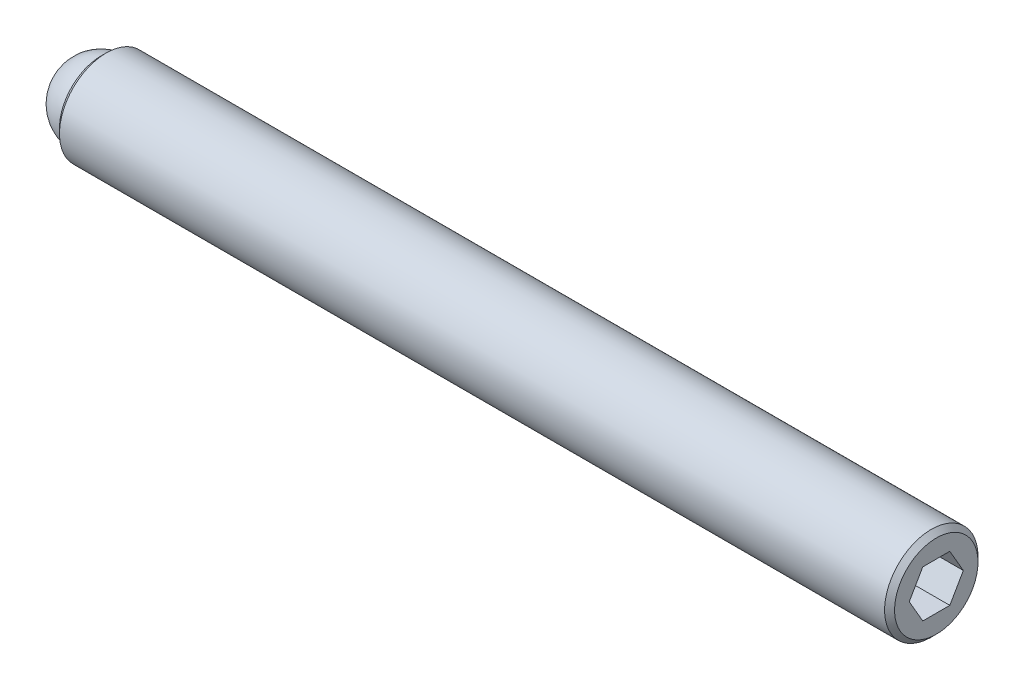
SolidWorks part; units mm, degrees
ref_plane "Front Plane" through (0, 0, 0) normal (0, 0, 1) x (1, 0, 0)
ref_plane "Top Plane" through (0, 0, 0) normal (0, 1, 0) x (1, 0, 0)
ref_plane "Right Plane" through (0, 0, 0) normal (1, 0, 0) x (0, 0, -1)
sketch "Sketch2" plane through (0, 0, 0) normal (1, 0, 0) x (0, 0, -1)
  circle A0 centre (0, 0) radius 2.3749
  dimension "D1" = 4.7498
extrude "Boss-Extrude1" add sketch "Sketch2" along normal blind 42.4656
sketch "Sketch3" plane through (0, 0, 0) normal (-1, 0, 0) x (0, 0, 1)
  circle A0 centre (0, 0) radius 1.9812
  dimension "D1" = 3.9624
chamfer "Chamfer1" distance 0.254 angle 45 1 edges at (0, 0, -2.3749)
chamfer "Chamfer2" distance 0.254 angle 45 1 edges at (42.4656, 0, -2.3749)
sketch "Sketch4" plane through (42.4656, 0, 0) normal (1, 0, 0) x (0, 0, -1)
  line L1 (1.3748, 0) -> (0.6874, 1.1906)
  line L2 (0.6874, 1.1906) -> (-0.6874, 1.1906)
  line L3 (-0.6874, 1.1906) -> (-1.3748, 0)
  line L4 (-1.3748, 0) -> (-0.6874, -1.1906)
  line L5 (-0.6874, -1.1906) -> (0.6874, -1.1906)
  line L6 (0.6874, -1.1906) -> (1.3748, 0)
  circle A0 centre (0, 0) radius 1.1906 construction
  dimension "D1" = 2.3813
extrude "Cut-Extrude2" cut sketch "Sketch4" against normal blind 2.286
extrude "Cut-Extrude3" cut sketch "Sketch3" against normal blind 1.9844
sketch "Sketch5" plane through (0, 0, 0) normal (-1, 0, 0) x (0, 0, 1)
  line L0 (0, 0) -> (0, -1.9844)
  line L1 (0, 0) -> (0, 1.9844)
  arc A0 (0, 1.9844) -> (0, -1.9844) centre (0, 0) ccw
  dimension "D1" = 1.9844
revolve "Revolve1" add sketch "Sketch5" angle 360 about L1
